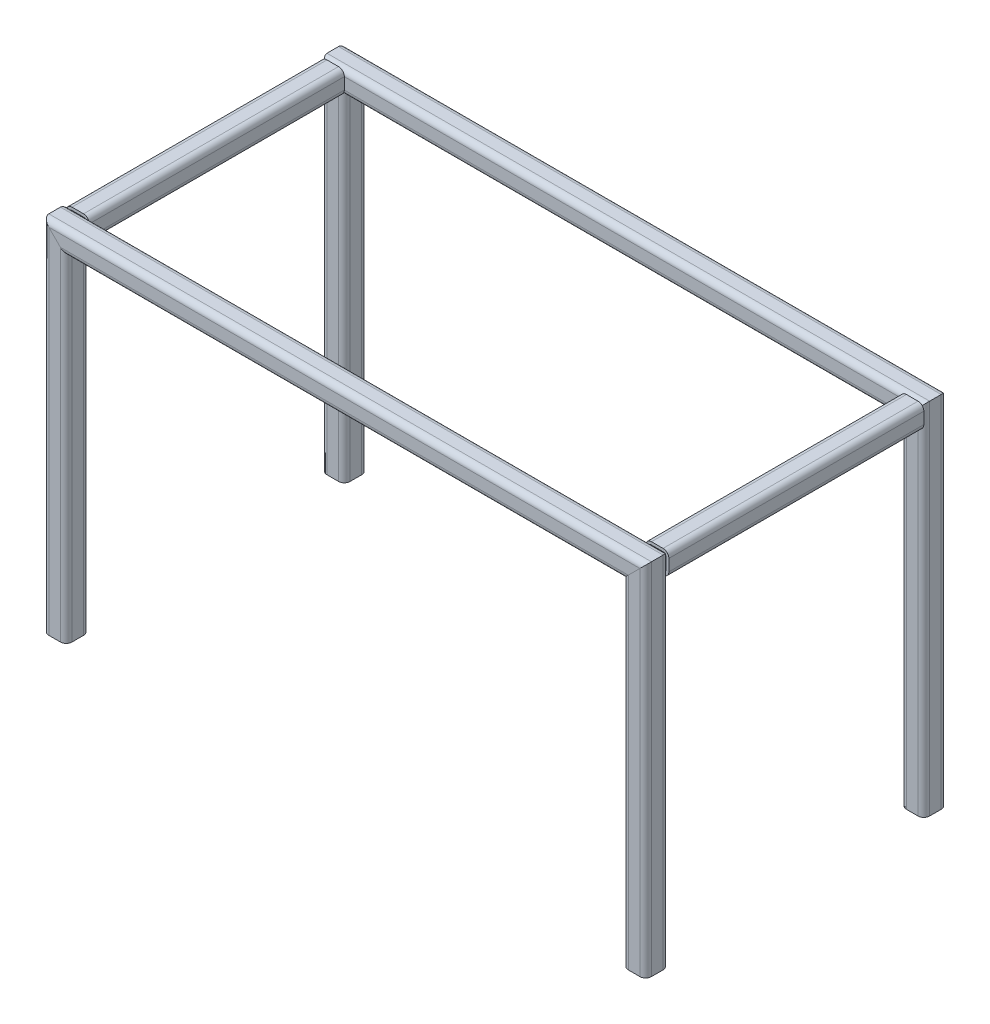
SolidWorks part; units mm, degrees
other "DetailItem1"
other "DetailItem2"
other "DetailItem3"
other "DetailItem4"
other "Weld Folder"
other "Weld Bead1"
other "Weld Bead3"
other "Weld Bead2"
other "Weld Bead4"
ref_plane "Front Plane" through (0, 0, 0) normal (0, 0, 1) x (1, 0, 0)
ref_plane "Top Plane" through (0, 0, 0) normal (0, 1, 0) x (1, 0, 0)
ref_plane "Right Plane" through (0, 0, 0) normal (1, 0, 0) x (0, 0, -1)
sketch3d "3DSketch1"
  line L0 (0, 0, 0) -> (0, 762, 0)
  line L1 (0, 762, 0) -> (1270, 762, 0)
  line L2 (1270, 762, 0) -> (1270, 0, 0)
  line L3 (0, 762, 0) -> (0, 762, -609.6)
  line L4 (0, 762, -609.6) -> (1270, 762, -609.6)
  line L5 (1270, 762, -609.6) -> (1270, 762, 0)
  line L6 (1270, 762, -609.6) -> (1270, 0, -609.6)
  line L7 (0, 762, -609.6) -> (0, 0, -609.6)
  dimension "D1" = 762
  dimension "D2" = 1270
  dimension "D3" = 609.6
other "Square tube 2 X 2 X 0.25(1)"
ref_plane "Plane1" through (0, 0, 0) normal (0, 1, 0) x (-1, 0, 0)
sketch "Sketch11" plane through (0, 0, 0) normal (0, 1, 0) x (-1, 0, 0)
  line L0 (-12.7, -19.05) -> (12.7, -19.05)
  line L1 (-19.05, -12.7) -> (-19.05, 12.7)
  line L2 (12.7, 19.05) -> (-12.7, 19.05)
  line L3 (19.05, 12.7) -> (19.05, -12.7)
  line L4 (-12.7, -25.4) -> (12.7, -25.4)
  line L5 (-25.4, -12.7) -> (-25.4, 12.7)
  line L6 (12.7, 25.4) -> (-12.7, 25.4)
  line L7 (25.4, 12.7) -> (25.4, -12.7)
  line L8 (0, 0) -> (19.05, 0) construction
  line L9 (0, 0) -> (0, 19.05) construction
  arc A0 (25.4, 12.7) -> (12.7, 25.4) centre (12.7, 12.7) ccw
  arc A1 (12.7, -25.4) -> (25.4, -12.7) centre (12.7, -12.7) ccw
  arc A2 (-25.4, -12.7) -> (-12.7, -25.4) centre (-12.7, -12.7) ccw
  arc A3 (-12.7, 25.4) -> (-25.4, 12.7) centre (-12.7, 12.7) ccw
  arc A4 (-12.7, 19.05) -> (-19.05, 12.7) centre (-12.7, 12.7) ccw
  arc A5 (19.05, 12.7) -> (12.7, 19.05) centre (12.7, 12.7) ccw
  arc A6 (12.7, -19.05) -> (19.05, -12.7) centre (12.7, -12.7) ccw
  arc A7 (-19.05, -12.7) -> (-12.7, -19.05) centre (-12.7, -12.7) ccw
  point P3 (0, 25.4)
  point P4 (25.4, 0)
  point P5 (0, -25.4)
  point P6 (-25.4, 0)
  point P7 (-25.4, 25.4)
  point P8 (-25.4, -25.4)
  point P33 (0, 0)
  point P35 (25.4, -25.4)
  point P36 (25.4, 25.4)
  point P37 (0, 0)
  point P38 (0, 0)
  point P39 (0, 0)
  dimension "D1" = 12.7
  dimension "Thickness" = 6.35
  dimension "V_leg" = 50.8
other "Square tube 2 X 2 X 0.25(3)"
ref_plane "Plane3" through (0, 762, 0) normal (0, 0, -1) x (1, 0, 0)
sketch "Sketch1" plane through (0, 762, 0) normal (0, 0, -1) x (1, 0, 0)
  line L0 (-12.7, -19.05) -> (12.7, -19.05)
  line L1 (-19.05, -12.7) -> (-19.05, 12.7)
  line L2 (12.7, 19.05) -> (-12.7, 19.05)
  line L3 (19.05, 12.7) -> (19.05, -12.7)
  line L4 (-12.7, -25.4) -> (12.7, -25.4)
  line L5 (-25.4, -12.7) -> (-25.4, 12.7)
  line L6 (12.7, 25.4) -> (-12.7, 25.4)
  line L7 (25.4, 12.7) -> (25.4, -12.7)
  line L8 (0, 0) -> (19.05, 0) construction
  line L9 (0, 0) -> (0, 19.05) construction
  arc A0 (25.4, 12.7) -> (12.7, 25.4) centre (12.7, 12.7) ccw
  arc A1 (12.7, -25.4) -> (25.4, -12.7) centre (12.7, -12.7) ccw
  arc A2 (-25.4, -12.7) -> (-12.7, -25.4) centre (-12.7, -12.7) ccw
  arc A3 (-12.7, 25.4) -> (-25.4, 12.7) centre (-12.7, 12.7) ccw
  arc A4 (-12.7, 19.05) -> (-19.05, 12.7) centre (-12.7, 12.7) ccw
  arc A5 (19.05, 12.7) -> (12.7, 19.05) centre (12.7, 12.7) ccw
  arc A6 (12.7, -19.05) -> (19.05, -12.7) centre (12.7, -12.7) ccw
  arc A7 (-19.05, -12.7) -> (-12.7, -19.05) centre (-12.7, -12.7) ccw
  point P3 (0, 25.4)
  point P4 (25.4, 0)
  point P5 (0, -25.4)
  point P6 (-25.4, 0)
  point P7 (-25.4, 25.4)
  point P8 (-25.4, -25.4)
  point P33 (0, 0)
  point P35 (25.4, -25.4)
  point P36 (25.4, 25.4)
  point P37 (0, 0)
  dimension "D1" = 12.7
  dimension "Thickness" = 6.35
  dimension "V_leg" = 50.8
other "Trim/Extend5"
other "Trim/Extend6"
other "Trim/Extend7"
other "Trim/Extend8"
other "Trim/Extend9"
other "Trim/Extend10"
other "Trim/Extend11"
other "Trim/Extend12"
